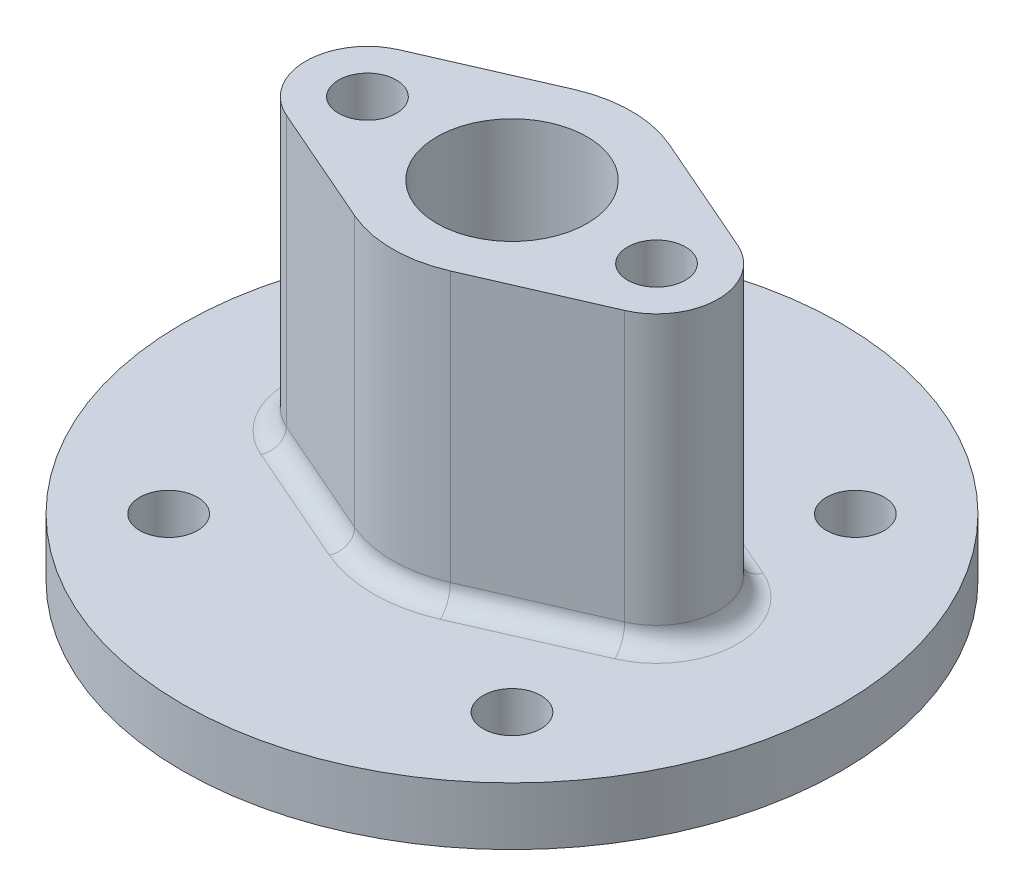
SolidWorks part; units mm, degrees
ref_plane "Front Plane" through (0, 0, 0) normal (0, 0, 1) x (1, 0, 0)
ref_plane "Top Plane" through (0, 0, 0) normal (0, 1, 0) x (1, 0, 0)
ref_plane "Right Plane" through (0, 0, 0) normal (1, 0, 0) x (0, 0, -1)
sketch "Sketch1" plane through (0, 0, 0) normal (0, 0, 1) x (1, 0, 0)
  line L0 (0, 0) -> (0, 65.7369) construction
  line L1 (0, 0) -> (24, 0)
  line L2 (24, 0) -> (42, 42)
  line L3 (42, 42) -> (85.5, 42)
  line L4 (85.5, 42) -> (85.5, 57)
  line L5 (85.5, 57) -> (0, 57)
  line L6 (0, 57) -> (0, 0)
  dimension "D1" = 48
  dimension "D2" = 171
  dimension "D3" = 15
  dimension "D4" = 42
  dimension "D5" = 84
revolve "Revolve1" add sketch "Sketch1" angle 360 about L0
sketch "Sketch2" plane through (0, 57, 0) normal (0, 1, 0) x (1, 0, 0)
  line L0 (-43.9, 14.6642) -> (-12.4, 28.412)
  line L1 (-43.9, -14.6642) -> (-12.4, -28.412)
  line L2 (43.9, 14.6642) -> (12.4, 28.412)
  line L3 (43.9, -14.6642) -> (12.4, -28.412)
  arc A0 (12.4, 28.412) -> (-12.4, 28.412) centre (0, 0) ccw
  arc A1 (-43.9, 14.6642) -> (-43.9, -14.6642) centre (-37.5, 0) ccw
  arc A2 (43.9, -14.6642) -> (43.9, 14.6642) centre (37.5, 0) ccw
  arc A3 (-12.4, -28.412) -> (12.4, -28.412) centre (0, 0) ccw
  dimension "D1" = 16
  dimension "D2" = 31
  dimension "D3" = 75
extrude "Extrude1" add sketch "Sketch2" along normal blind 75
sketch "Sketch3" plane through (0, 0, 0) normal (0, 0, 1) x (1, 0, 0)
  line L0 (0, 0) -> (0, 132)
  line L1 (12.4, 132) -> (-12.4, 132) construction
  line L2 (0, 132) -> (19.5, 132)
  line L3 (12.4, 132) -> (43.9, 132) construction
  line L4 (19.5, 132) -> (19.5, 102)
  line L5 (10.5, 100) -> (19.5, 102)
  line L6 (10.5, 100) -> (10.5, 90)
  line L7 (10.5, 90) -> (19.5, 90)
  line L8 (19.5, 90) -> (19.5, 66)
  line L9 (19.5, 66) -> (10.5, 66)
  line L10 (10.5, 66) -> (10.5, 0)
  line L11 (-24, 0) -> (24, 0) construction
  line L12 (10.5, 0) -> (0, 0)
  line L13 (0, 148.0093) -> (0, 0) construction
  dimension "D1" = 21
  dimension "D2" = 39
  dimension "D3" = 21
  dimension "D4" = 30
  dimension "D5" = 24
  dimension "D6" = 10
  dimension "D7" = 2
revolve "Cut-Revolve1" cut sketch "Sketch3" angle 360 about L13
fillet "Fillet1" radius 5 8 edges at (0, 57, 31) (-28.15, 57, 21.5381) (-53.5, 57, 0) (-28.15, 57, -21.5381) (0, 57, -31) (28.15, 57, -21.5381) (53.5, 57, 0) (28.15, 57, 21.5381)
sketch "Sketch4" plane through (0, 57, 0) normal (0, 1, 0) x (1, 0, 0)
  circle A0 centre (0, 0) radius 63 construction
  dimension "D1" = 126
hole_wizard "Ø15.0 (15) Diameter Hole1" positions "3DSketch1" profile "Sketch5" hole size "Ø15.0" standard "Ansi Metric"
sketch3d "3DSketch1"
  line L0 (-37.5, 132, 0) -> (-37.5, 62, 0) construction
  line L1 (37.5, 132, 0) -> (37.5, 62, 0) construction
  point P0 (-37.5, 132, 0)
  point P4 (37.5, 132, 0)
sketch "Sketch5" plane through (-37.5, 132, 0) normal (1, 0, 0) x (0, 0, 1)
  line L0 (0, 0) -> (0, 29.5065)
  line L1 (0, 29.5065) -> (7.5, 25)
  line L2 (7.5, 25) -> (7.5, 0)
  line L5 (7.5, 0) -> (0, 0)
  line L10 (0, 29.5065) -> (-7.5, 25) construction
  line L11 (0, -6.35) -> (0, 107.95) construction
  dimension "Hole Dia." = 15
  dimension "Hole Depth" = 25
  dimension "Drill Angle" = 118
other "Hole1" parameters "D1"=75
sketch "Sketch6" plane through (0, 57, 0) normal (0, 1, 0) x (-1, 0, 0)
  circle A0 centre (-44.5477, -44.5477) radius 7.5
  circle A1 centre (0, 0) radius 63 construction
  point P2 (-63, 0)
  dimension "D1" = 15
  dimension "D2" = 45
pattern_circular "CirPattern1" count 4 over 360 about axis through (0, 0, 0) along (0, 1, 0) of "Hole1"
